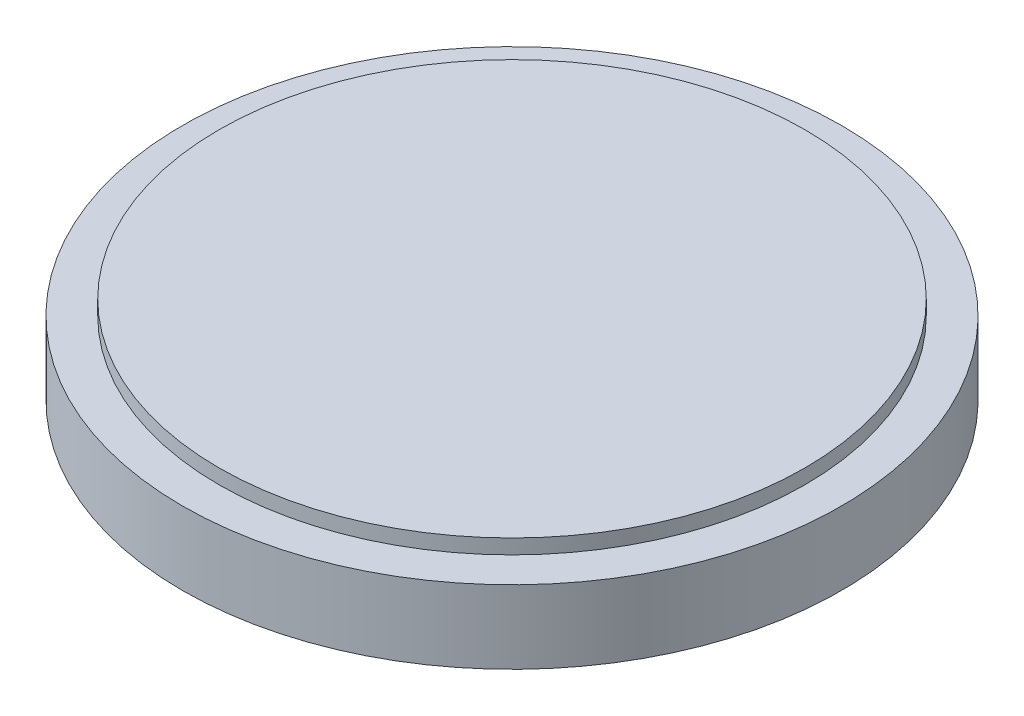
SolidWorks part; units mm, degrees
ref_plane "前视基准面" through (0, 0, 0) normal (0, 0, 1) x (1, 0, 0)
ref_plane "上视基准面" through (0, 0, 0) normal (0, 1, 0) x (1, 0, 0)
ref_plane "右视基准面" through (0, 0, 0) normal (1, 0, 0) x (0, 0, -1)
other "Configuration Table"
sketch "草图1" plane through (0, 0, 0) normal (0, 1, 0) x (1, 0, 0)
  circle A0 centre (0, 0) radius 45
  dimension "D1" = 90
extrude "凸台-拉伸1" add sketch "草图1" along normal blind 10
sketch "草图2" plane through (0, 10, 0) normal (0, 1, 0) x (1, 0, 0)
  circle A0 centre (0, 0) radius 40
  dimension "D1" = 80
extrude "凸台-拉伸2" add sketch "草图2" along normal blind 2
